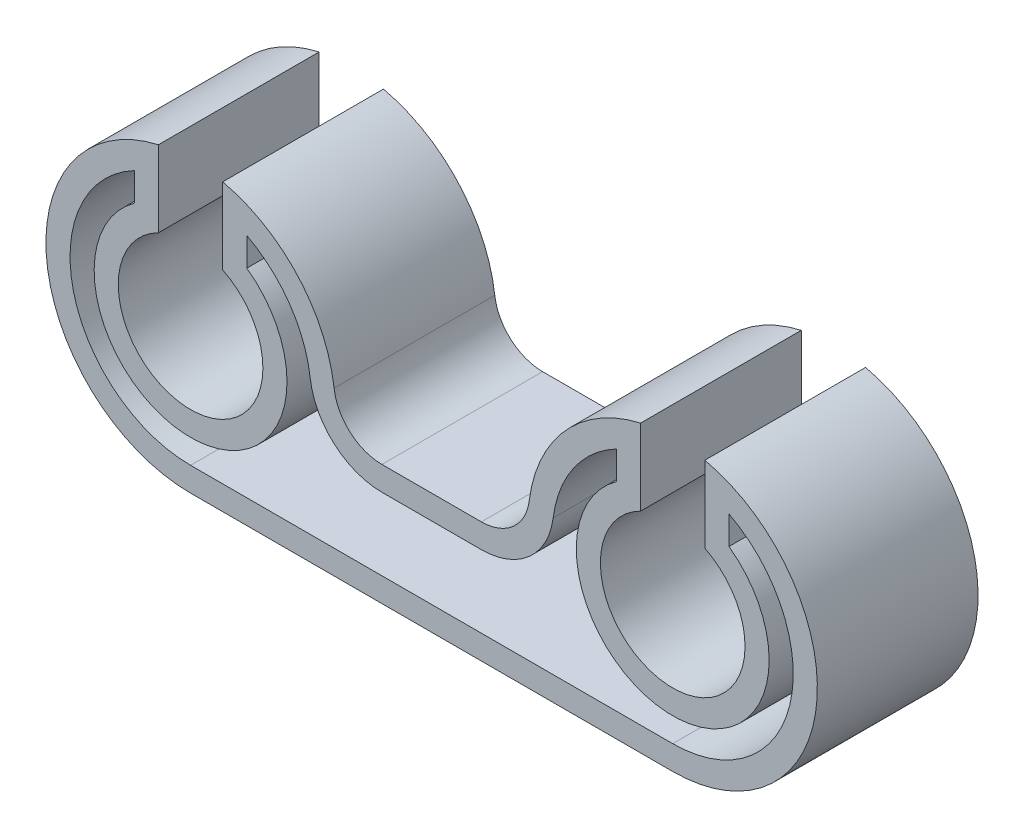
SolidWorks part; units mm, degrees
ref_plane "Front Plane" through (0, 0, 0) normal (0, 0, 1) x (1, 0, 0)
ref_plane "Top Plane" through (0, 0, 0) normal (0, 1, 0) x (1, 0, 0)
ref_plane "Right Plane" through (0, 0, 0) normal (1, 0, 0) x (0, 0, -1)
sketch "Sketch1" plane through (0, 0, 0) normal (0, 0, 1) x (1, 0, 0)
  line L0 (0, 0) -> (0, 19.2711) construction
  line L1 (-30, -18) -> (30, -18)
  line L2 (-30, 0) -> (-30, 14.6541) construction
  line L3 (-6.1882, -3) -> (6.1882, -3)
  line L5 (-34, 17.5499) -> (-34, 8.0623)
  line L7 (-26, 17.5499) -> (-26, 8.0623)
  line L9 (26, 17.5499) -> (26, 8.0623)
  line L11 (34, 17.5499) -> (34, 8.0623)
  line L12 (30, 0) -> (30, 14.6541) construction
  arc A0 (12.1412, 2.25) -> (6.1882, -3) centre (6.1882, 3) cw
  arc A1 (-6.1882, -3) -> (-12.1412, 2.25) centre (-6.1882, 3) cw
  arc A2 (-12.1412, 2.25) -> (-26, 17.5499) centre (-30, 0) ccw
  arc A3 (30, -18) -> (34, 17.5499) centre (30, 0) ccw
  arc A4 (-34, 8.0623) -> (-26, 8.0623) centre (-30, 0) ccw
  arc A5 (26, 8.0623) -> (34, 8.0623) centre (30, 0) ccw
  arc A6 (-34, 17.5499) -> (-30, -18) centre (-30, 0) ccw
  arc A7 (26, 17.5499) -> (12.1412, 2.25) centre (30, 0) ccw
  dimension "D1" = 6
  dimension "D3" = 18
  dimension "D5" = 9
  dimension "D2" = 60
  dimension "D4" = 15
  dimension "D6" = 8
  dimension "D7" = 8
extrude "Extrude-Thin3" add sketch "Sketch1" along normal mid plane 20 thin
